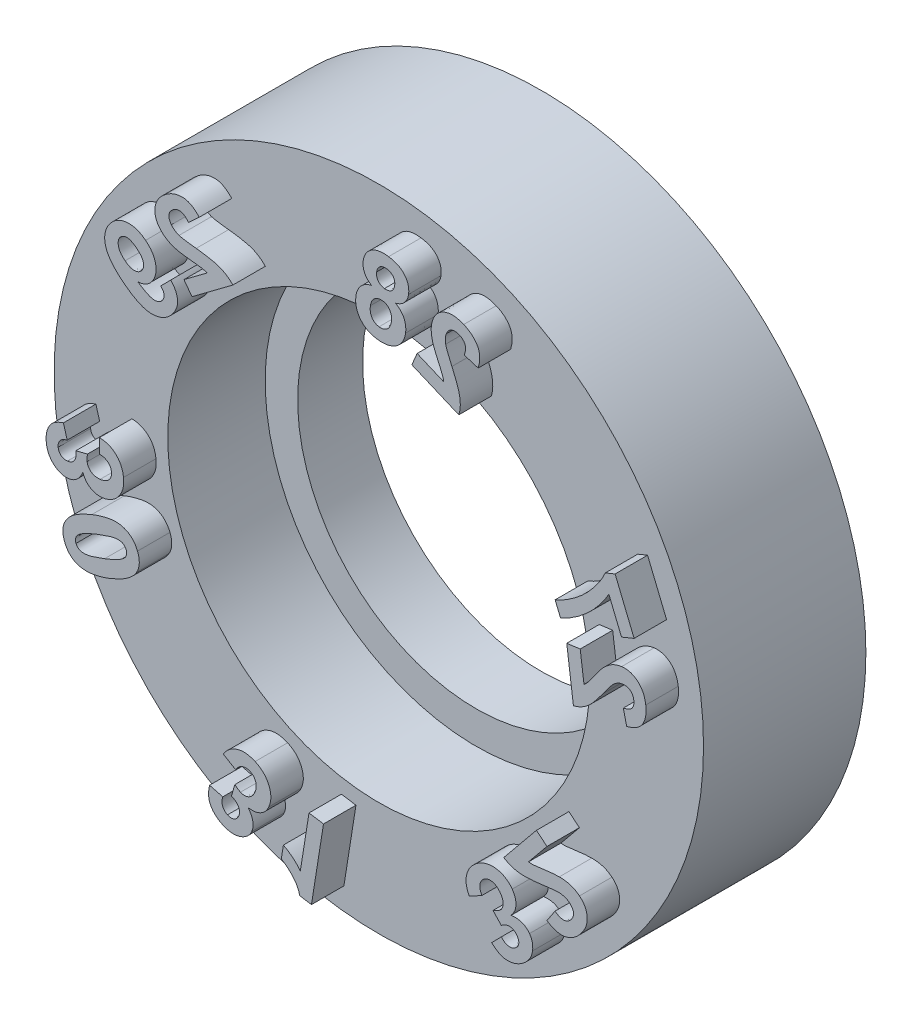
SolidWorks part; units mm, degrees
ref_plane "Front Plane" through (0, 0, 0) normal (0, 0, 1) x (1, 0, 0)
ref_plane "Top Plane" through (0, 0, 0) normal (0, 1, 0) x (1, 0, 0)
ref_plane "Right Plane" through (0, 0, 0) normal (1, 0, 0) x (0, 0, -1)
imported_body "Imported1"
other "DeleteFace1"
sketch "Sketch1" plane through (0, 0, 0) normal (0, 0, 1) x (1, 0, 0)
  line L0 (0, 0) -> (0, 11.8635) construction
  line L1 (0, 0) -> (10.2741, 5.9318) construction
  line L2 (0, 0) -> (10.2741, -5.9318) construction
  line L3 (0, 0) -> (0, -11.8635) construction
  line L4 (0, 0) -> (-10.2741, -5.9318) construction
  line L5 (0, 0) -> (-10.2741, 5.9318) construction
  circle A0 centre (0, 0) radius 7.0035 construction
  text T0 "27    28    29    30    31    32" font "Arial" height 2.37
  point P12 (0, 0)
  dimension "D1" = 6
extrude "Boss-Extrude1" add sketch "Sketch1" along normal blind 1
